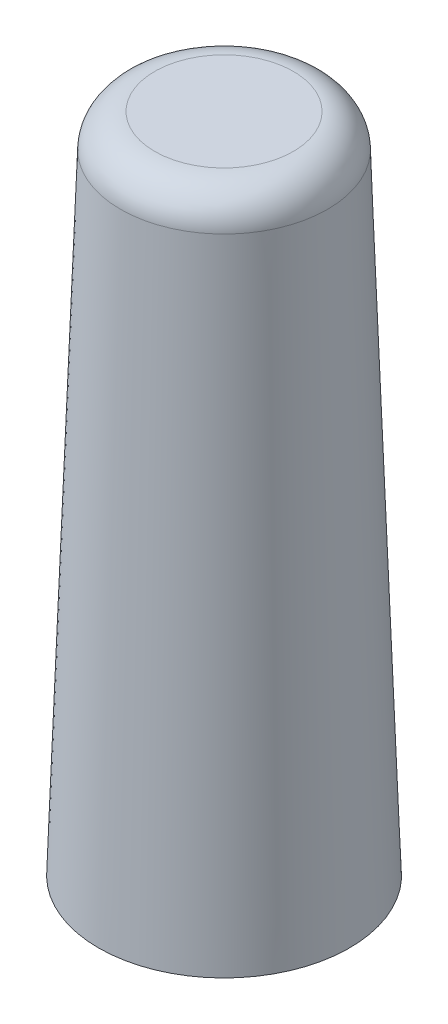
SolidWorks part; units mm, degrees
ref_plane "Front Plane" through (0, 0, 0) normal (0, 0, 1) x (1, 0, 0)
ref_plane "Top Plane" through (0, 0, 0) normal (0, 1, 0) x (1, 0, 0)
ref_plane "Right Plane" through (0, 0, 0) normal (1, 0, 0) x (0, 0, -1)
sketch "Sketch1" plane through (0, 0, 0) normal (0, 1, 0) x (1, 0, 0)
  circle A0 centre (0, 0) radius 11
  dimension "D1" = 22
extrude "Boss-Extrude1" add sketch "Sketch1" along normal blind 58 draft 2
fillet "Fillet1" radius 3 1 edges at (0, 58, 8.9746)
